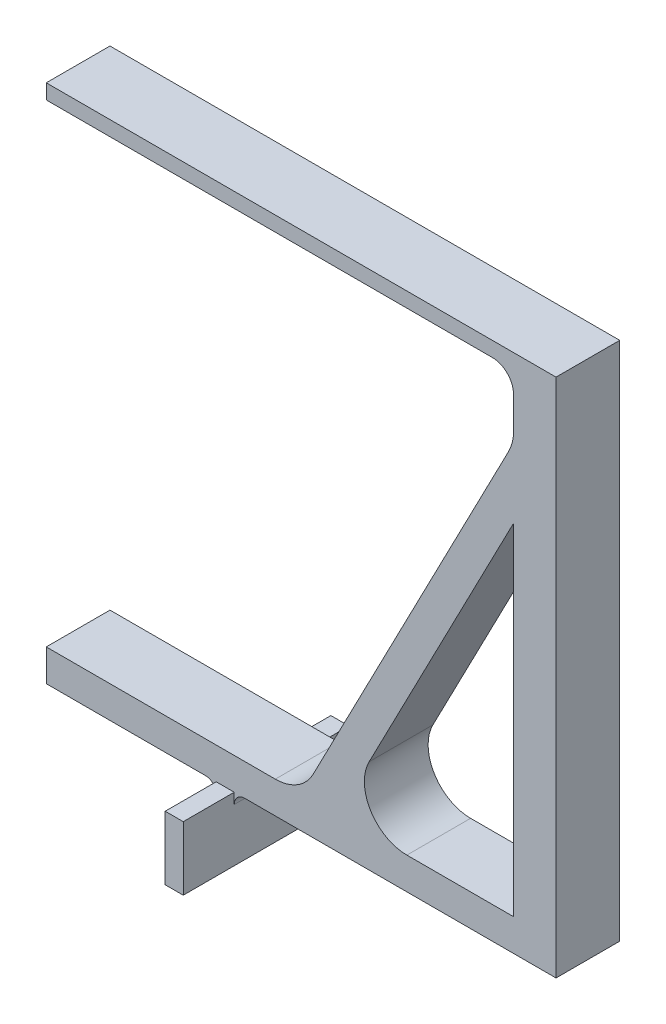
SolidWorks part; units mm, degrees
ref_plane "Front Plane" through (0, 0, 0) normal (0, 0, 1) x (1, 0, 0)
ref_plane "Top Plane" through (0, 0, 0) normal (0, 1, 0) x (1, 0, 0)
ref_plane "Right Plane" through (0, 0, 0) normal (1, 0, 0) x (0, 0, -1)
sketch "Sketch1" plane through (0, 0, 0) normal (0, 0, 1) x (1, 0, 0)
  line L2 (0, 3) -> (0, 0)
  line L3 (0, 0) -> (0.85, 0)
  line L4 (0.85, 3) -> (0.85, 0)
  line L5 (-4, 4.5) -> (4, 4.5)
  line L7 (0.85, 3) -> (16, 3)
  line L10 (16, 3) -> (16, 27.5)
  line L12 (14, 4.5) -> (14, 20.5395)
  line L13 (14, 27.5) -> (-8, 27.5)
  line L15 (14, 26.8) -> (-8, 26.8)
  line L16 (-8, 27.5) -> (-8, 26.8)
  line L17 (14, 27.5) -> (16, 27.5)
  line L18 (14, 23.8) -> (4, 4.5)
  line L19 (5.6894, 4.5) -> (14, 20.5395)
  line L20 (5.6894, 4.5) -> (14, 4.5)
  line L21 (14, 23.8) -> (14, 26.8)
  line L25 (0, 3) -> (-4, 3)
  line L26 (-4, 4.5) -> (-4, 3)
  dimension "D1" = 0.85
  dimension "D2" = 1.5
  dimension "D3" = 3
  dimension "D4" = 23.8
  dimension "D5" = 0.7
  dimension "D6" = 22
  dimension "D7" = 2
  dimension "D8" = 8
  dimension "D9" = 1.5
  dimension "D10" = 18
  dimension "D11" = 3
  dimension "D12" = 4
extrude "Boss-Extrude1" add sketch "Sketch1" along normal blind 3
fillet "Fillet1" radius 2 3 edges at (14, 23.8, 1.5) (4, 4.5, 1.5) (5.6894, 4.5, 1.5)
fillet "Fillet2" radius 1 1 edges at (14, 26.8, 1.5)
sketch "Sketch2" plane through (0, 0, 3) normal (0, 0, 1) x (1, 0, 0)
  line L1 (0, 0) -> (0.85, 0)
  line L2 (0, 0) -> (0, 3)
  line L3 (0, 3) -> (0.85, 3)
  line L4 (0.85, 0) -> (0.85, 3)
extrude "Boss-Extrude2" add sketch "Sketch2" along normal blind 2.4 and the other way blind 5.4
fillet "Fillet3" radius 0.5 2 edges at (0, 3, 1.5) (0.85, 3, 1.5)
sketch "Sketch3" plane through (-4, 0, 0) normal (-1, 0, 0) x (0, 0, 1)
  line L1 (0, 3) -> (3, 3)
  line L2 (0, 3) -> (0, 4.5)
  line L3 (0, 4.5) -> (3, 4.5)
  line L4 (3, 3) -> (3, 4.5)
extrude "Boss-Extrude3" add sketch "Sketch3" along normal blind 4
